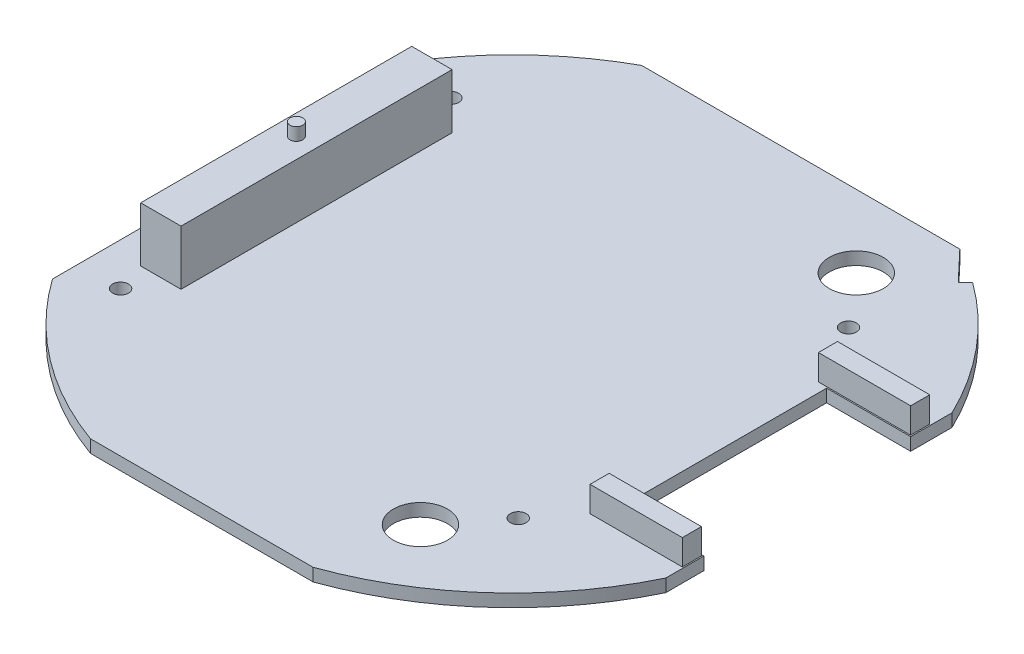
SolidWorks part; units mm, degrees
ref_plane "Front Plane" through (0, 0, 0) normal (0, 0, 1) x (1, 0, 0)
ref_plane "Top Plane" through (0, 0, 0) normal (0, 1, 0) x (1, 0, 0)
ref_plane "Right Plane" through (0, 0, 0) normal (1, 0, 0) x (0, 0, -1)
sketch "Sketch1" plane through (0, 0, 0) normal (0, 1, 0) x (1, 0, 0)
  line L0 (-53.6301, 38.1) -> (-53.6301, 5.08)
  line L1 (59.2559, 28.575) -> (59.2559, 20.2946)
  line L2 (59.2559, 20.2946) -> (42.4919, 20.2946)
  line L3 (42.4919, 20.2946) -> (42.4919, -20.955)
  line L4 (42.4919, -20.955) -> (59.2559, -20.955)
  line L5 (59.2559, -20.955) -> (59.2559, -28.575)
  line L6 (-45.1846, 32.9565) -> (-45.1846, -32.9565) construction
  line L7 (-45.1846, 0) -> (0, 0) construction
  line L8 (34.1904, 31.369) -> (34.1904, -31.369) construction
  line L9 (32.6029, -32.9565) -> (-43.5971, -32.9565) construction
  line L10 (0, 0) -> (34.1904, 0) construction
  line L11 (-45.1846, 0) -> (-46.0101, 0) construction
  line L12 (-51.0901, 5.08) -> (-53.6301, 5.08)
  line L13 (-22.225, -61.9181) -> (22.225, -61.9181)
  line L14 (-31.75, 57.6171) -> (31.75, 57.6171)
  line L15 (-53.6301, -5.08) -> (-51.0901, -5.08)
  line L16 (-53.6301, -5.08) -> (-53.6301, -38.1)
  line L17 (31.75, 57.6171) -> (37.3404, 51.717)
  line L18 (37.3404, 51.717) -> (38.8154, 53.1146)
  line L19 (31.75, 57.6171) -> (31.75, 20.2946) construction
  line L20 (31.75, 20.2946) -> (42.4919, 20.2946) construction
  arc A0 (-53.6301, -38.1) -> (-22.225, -61.9181) centre (0, 0) ccw
  arc A1 (59.2559, 28.575) -> (38.8154, 53.1146) centre (0, 0) ccw
  circle A2 centre (-45.1846, 32.9565) radius 1.5875
  circle A3 centre (-45.1846, -32.9565) radius 1.5875
  circle A4 centre (34.1904, 32.9565) radius 1.5875
  circle A5 centre (34.1904, -32.9565) radius 1.5875
  arc A6 (-51.0901, -5.08) -> (-51.0901, 5.08) centre (-51.0901, 0) ccw
  arc A7 (22.225, -61.9181) -> (59.2559, -28.575) centre (0, 0) ccw
  arc A8 (-31.75, 57.6171) -> (-53.6301, 38.1) centre (0, 0) ccw
  point P14 (-45.1846, 31.369)
  point P15 (-45.1846, -31.369)
  point P17 (-46.7721, -32.9565)
  point P24 (32.6029, 32.9565)
  point P25 (-43.5971, 32.9565)
  point P31 (-46.0101, 0)
  dimension "D1" = 76.2
  dimension "D2" = 131.572
  dimension "D9" = 3.175
  dimension "D11" = 10.16
  dimension "D3" = 57.15
  dimension "D4" = 41.2496
  dimension "D5" = 16.764
  dimension "D6" = 7.62
  dimension "D7" = 62.738
  dimension "D8" = 6.858
  dimension "D10" = 76.2
  dimension "D12" = 7.62
  dimension "D13" = 44.45
  dimension "D14" = 63.5
  dimension "D15" = 8.128
  dimension "D16" = 2.032
  dimension "D17" = 10.7419
extrude "Boss-Extrude1" add sketch "Sketch1" along normal blind 2.54 contours L0 A0 L5 L4 L3 L2 L1 A1
sketch "Sketch2" plane through (0, 2.54, 0) normal (0, 1, 0) x (1, 0, 0)
  line L0 (-53.6301, 38.1) -> (-53.6301, 5.08) construction
  line L1 (-47.0769, 27.051) -> (-39.0251, 27.051)
  line L2 (-47.0769, 27.051) -> (-47.0769, -27.051)
  line L3 (-47.0769, -27.051) -> (-39.0251, -27.051)
  line L4 (-39.0251, 27.051) -> (-39.0251, -27.051)
  line L5 (-53.6301, -5.08) -> (-53.6301, 5.08) construction
  line L6 (-39.0251, 0) -> (-47.0769, 0) construction
  line L7 (-47.0769, 0) -> (-53.6301, 0) construction
  dimension "D1" = 54.102
  dimension "D2" = 8.0518
  dimension "D3" = 14.605
extrude "Boss-Extrude2" add sketch "Sketch2" along normal blind 10.922 contours L4 L3 L2 L1
sketch "Sketch3" plane through (0, 2.54, 0) normal (0, 1, 0) x (1, 0, 0)
  line L0 (59.2559, -28.575) -> (59.2559, -20.955) construction
  line L1 (40.5869, 24.3586) -> (59.0019, 24.3586)
  line L2 (40.5869, 24.3586) -> (40.5869, 20.5486)
  line L3 (40.5869, 20.5486) -> (59.0019, 20.5486)
  line L4 (59.0019, 24.3586) -> (59.0019, 20.5486)
  line L5 (40.5869, -25.019) -> (59.0019, -25.019)
  line L6 (40.5869, -25.019) -> (40.5869, -21.209)
  line L7 (40.5869, -21.209) -> (59.0019, -21.209)
  line L8 (59.0019, -25.019) -> (59.0019, -21.209)
  line L9 (59.2559, -20.955) -> (42.4919, -20.955) construction
  line L10 (42.4919, 20.2946) -> (59.2559, 20.2946) construction
  line L11 (59.2559, 20.2946) -> (59.2559, 28.575) construction
  line L12 (42.4919, -20.955) -> (42.4919, 20.2946) construction
  dimension "D1" = 0.254
  dimension "D2" = 0.254
  dimension "D3" = 3.81
  dimension "D4" = 3.81
  dimension "D5" = 0.254
  dimension "D6" = 0.254
  dimension "D7" = 1.905
  dimension "D8" = 1.905
extrude "Boss-Extrude3" add sketch "Sketch3" along normal blind 5.08
sketch "Sketch4" plane through (0, 13.462, 0) normal (0, 1, 0) x (1, 0, 0)
  line L0 (-43.051, 27.051) -> (-43.051, 0) construction
  line L1 (-39.0251, 27.051) -> (-47.0769, 27.051) construction
  line L2 (-43.051, 0) -> (-39.0251, 0) construction
  line L3 (-39.0251, -27.051) -> (-39.0251, 27.051) construction
  circle A0 centre (-43.051, 0) radius 1.27
  dimension "D1" = 2.54
extrude "Boss-Extrude4" add sketch "Sketch4" along normal blind 2.54
sketch "Sketch5" plane through (0, 2.54, 0) normal (0, 1, 0) x (1, 0, 0)
  line L0 (25.5374, 43.1673) -> (25.5374, -43.8277) construction
  line L2 (59.2559, 20.2946) -> (59.2559, 28.575) construction
  line L3 (42.4919, -0.3302) -> (25.5374, -0.3302) construction
  line L4 (42.4919, -20.955) -> (42.4919, 20.2946) construction
  circle A0 centre (25.5374, 43.1673) radius 5.3975
  circle A1 centre (25.5374, -43.8277) radius 5.3975
  point P4 (20.1399, -43.8277)
  point P6 (20.1399, 43.1673)
  point P8 (25.5374, 37.7698)
  point P9 (25.5374, -38.4302)
  dimension "D1" = 10.795
  dimension "D2" = 10.795
  dimension "D3" = 39.116
  dimension "D4" = 76.2
extrude "Cut-Extrude1" cut sketch "Sketch5" against normal through all
